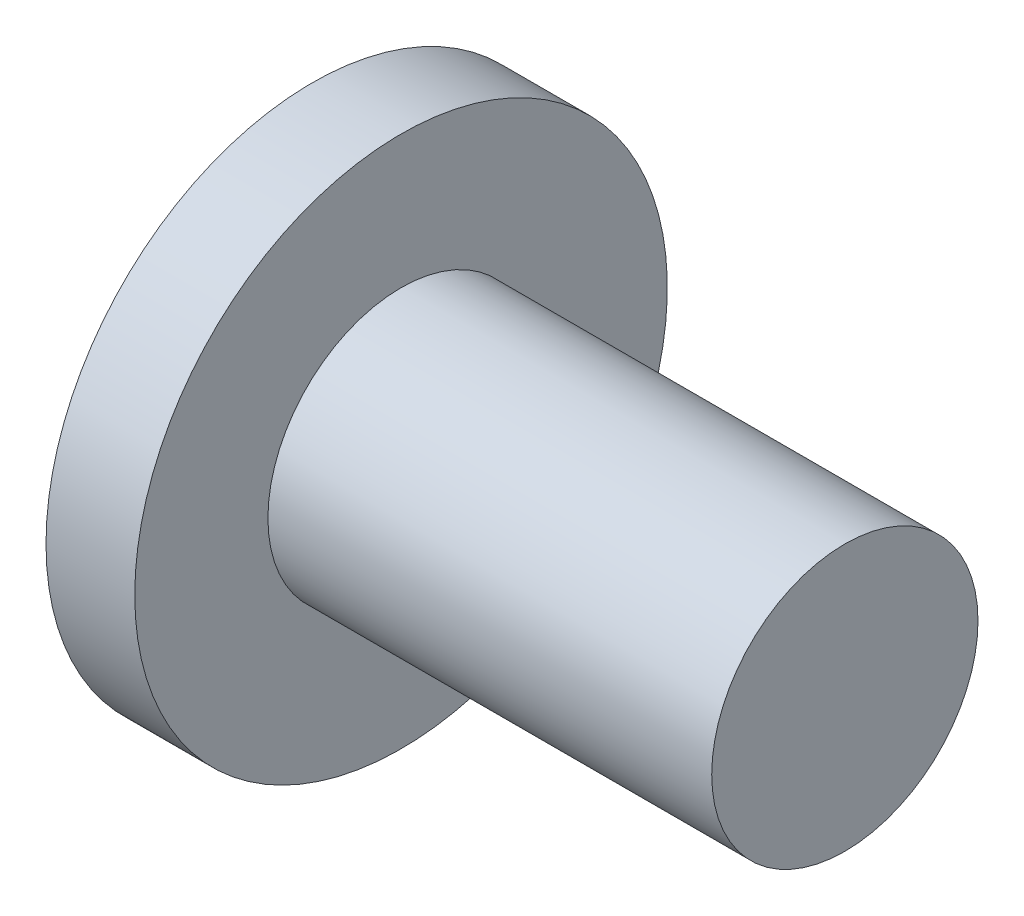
SolidWorks part; units mm, degrees
ref_plane "Front Plane" through (0, 0, 0) normal (0, 0, 1) x (1, 0, 0)
ref_plane "Top Plane" through (0, 0, 0) normal (0, 1, 0) x (1, 0, 0)
ref_plane "Right Plane" through (0, 0, 0) normal (1, 0, 0) x (0, 0, -1)
sketch "Sketch1" plane through (0, 0, 0) normal (0, 0, 1) x (1, 0, 0)
  line L0 (-7.3487, 0) -> (10.577, 0) construction
  line L2 (-2.5664, 3) -> (7.4336, 3)
  line L4 (-1.8903, 0) -> (7.4336, 0)
  line L5 (7.4336, 3) -> (7.4336, 0)
  line L6 (-4.5664, 6) -> (-2.5664, 6)
  line L7 (-4.5664, 6) -> (-4.5664, 0)
  line L8 (-4.5664, 0) -> (-1.8903, 0)
  line L9 (-2.5664, 6) -> (-2.5664, 3)
  dimension "D1" = 12
  dimension "D2" = 6
  dimension "D3" = 2
  dimension "D4" = 10
revolve "Revolve1" add sketch "Sketch1" angle 360 about L0
scale "Scale1" scale about centroid uniform scaling yes scale factor 0.75
